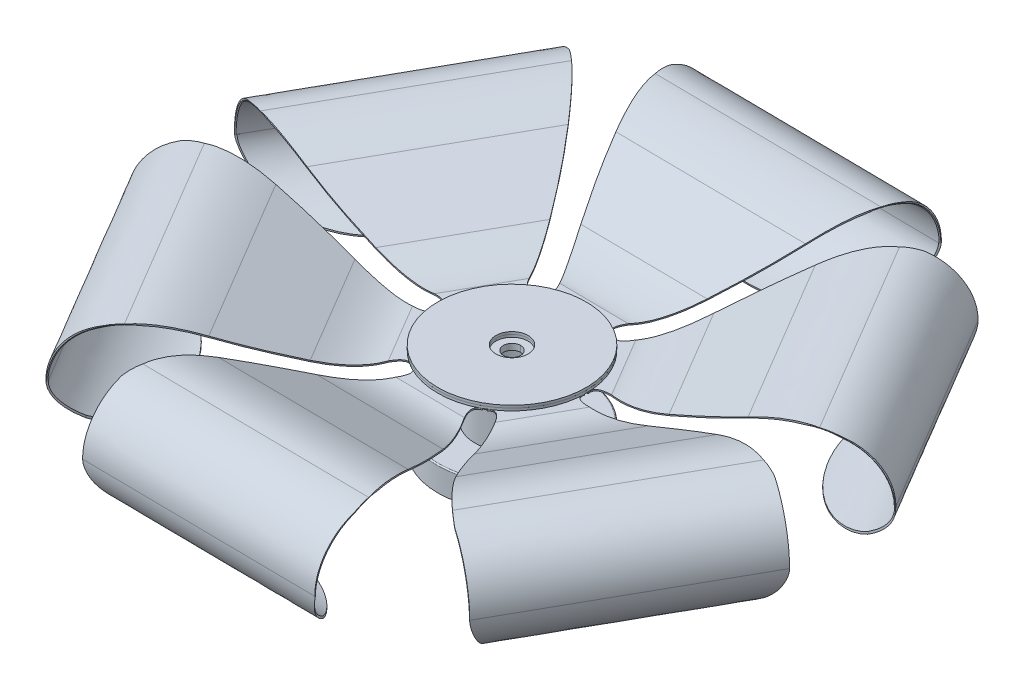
SolidWorks part; units mm, degrees
ref_plane "Alzado" through (0, 0, 0) normal (0, 0, 1) x (1, 0, 0)
ref_plane "Planta" through (0, 0, 0) normal (0, 1, 0) x (1, 0, 0)
ref_plane "Vista lateral" through (0, 0, 0) normal (1, 0, 0) x (0, 0, -1)
imported_body "PRT0012.stp-1-solid1"
imported_body "PRT0010.stp-1-solid1"
imported_body "PRT0009.stp-1-solid1"
imported_body "PRT0011.stp-1-solid1"
imported_body "petalo final-1-solid1"
imported_body "petalo final-2-solid1"
imported_body "petalo final-3-solid1"
imported_body "petalo final-4-solid1"
imported_body "petalo final-5-solid1"
imported_body "petalo final-6-solid1"
sketch "Croquis1" plane through (0, 71.9, 0) normal (0, 1, 0) x (1, 0, 0)
  circle A0 centre (60, 60) radius 60
  circle A1 centre (60, 60) radius 13
extrude "Saliente-Extruir1" add sketch "Croquis1" along normal blind 2 separate body
